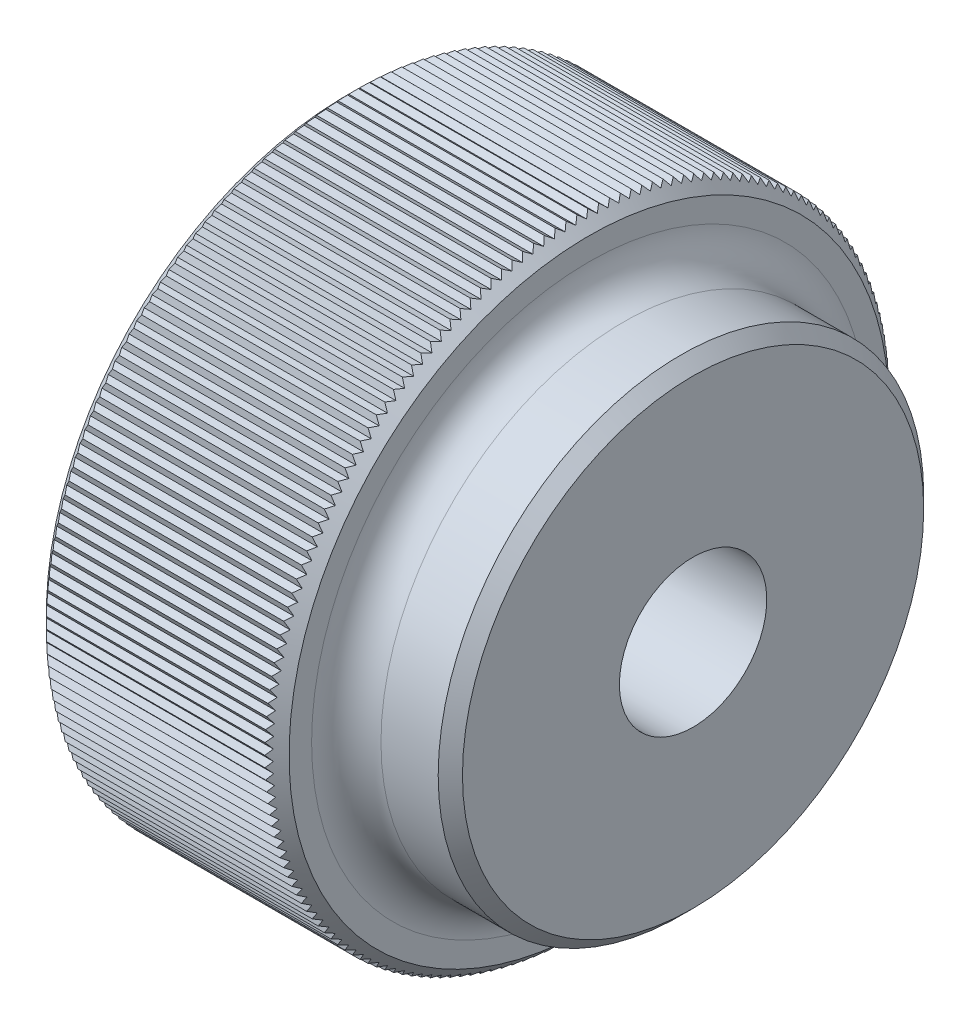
SolidWorks part; units mm, degrees
ref_plane "Front Plane" through (0, 0, 0) normal (0, 0, 1) x (1, 0, 0)
ref_plane "Top Plane" through (0, 0, 0) normal (0, 1, 0) x (1, 0, 0)
ref_plane "Right Plane" through (0, 0, 0) normal (1, 0, 0) x (0, 0, -1)
sketch "Sketch1" plane through (0, 0, 0) normal (1, 0, 0) x (0, 0, -1)
  circle A0 centre (0, 0) radius 18
  dimension "D1" = 36
extrude "Extrude1" add sketch "Sketch1" against normal blind 14
chamfer "Chamfer1" distance 0.7 angle 45 2 edges at (-14, 0, -18) (0, 0, -18)
sketch "Sketch2" plane through (0, 0, 0) normal (1, 0, 0) x (0, 0, -1)
  line L0 (0, 0) -> (0, 50000) construction
  line L1 (0, 0) -> (-872.6203, 49992.3848) construction
  line L2 (0, 18) -> (-0.3098, 17.75)
  line L3 (-0.6282, 17.989) -> (-0.3098, 17.75)
  circle A0 centre (0, 0) radius 18 construction
  arc A1 (-0.6282, 17.989) -> (0, 18) centre (-0.3211, 18.398) cw
  dimension "D1" = 1
  dimension "D2" = 0.25
extrude "Extrude2" cut sketch "Sketch2" against normal through all
pattern_circular "CirPattern1" count 180 over 360 about axis through (0, 0, 0) along (1, 0, 0) of "Extrude2"
sketch "Sketch3" plane through (0, 0, 0) normal (1, 0, 0) x (0, 0, -1)
  circle A0 centre (0, 0) radius 14
  dimension "D1" = 28
extrude "Extrude3" add sketch "Sketch3" along normal blind 6
fillet "Fillet1" radius 2 1 edges at (0, 0, -14)
sketch "Sketch4" plane through (-14, 0, 0) normal (-1, 0, 0) x (0, 0, 1)
  circle A0 centre (0, 0) radius 4.25
  dimension "D1" = 8.5
extrude "Extrude4" cut sketch "Sketch4" against normal through all
sketch "Sketch5" plane through (-14, 0, 0) normal (-1, 0, 0) x (0, 0, 1)
  circle A0 centre (0, 0) radius 15
  dimension "D1" = 30
extrude "Extrude5" cut sketch "Sketch5" against normal blind 8
chamfer "Chamfer2" distance 0.7 angle 45 3 edges at (-14, 0, 15) (6, 0, -14) (-6, 0, 4.25)
sketch "Sketch6" plane through (0, 0, 0) normal (0, 0, 1) x (1, 0, 0)
  line L0 (6, -13.3) -> (6, 13.3) construction
  circle A0 centre (2, 0) radius 1.45
  dimension "D1" = 2.9
  dimension "D2" = 4
extrude "Extrude6" [suppressed] cut sketch "Sketch6" along normal through all
